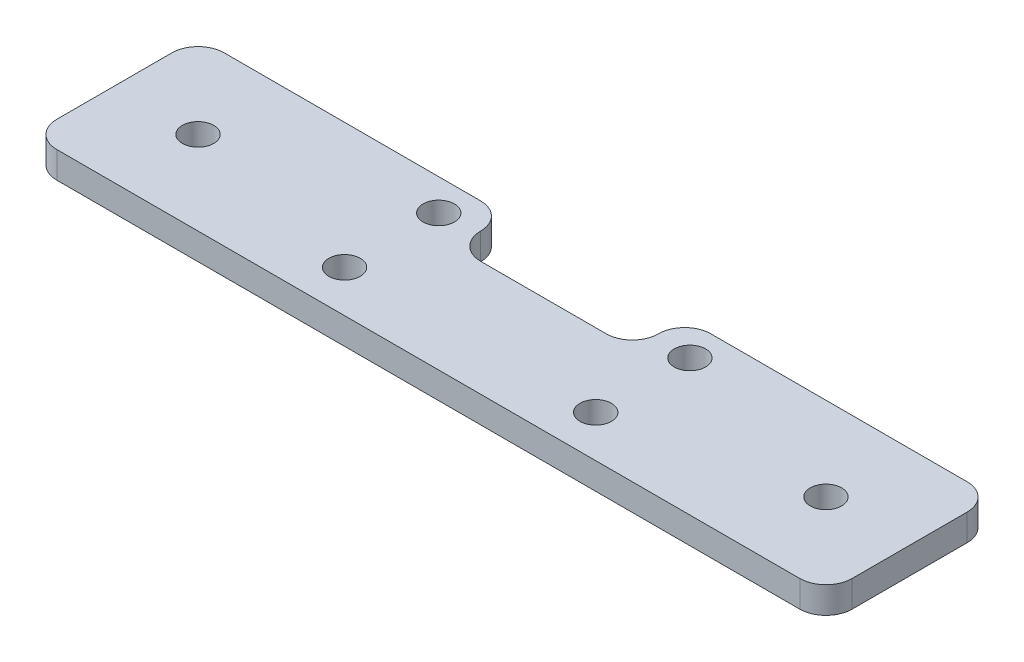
SolidWorks part; units mm, degrees
ref_plane "Front Plane" through (0, 0, 0) normal (0, 0, 1) x (1, 0, 0)
ref_plane "Top Plane" through (0, 0, 0) normal (0, 1, 0) x (1, 0, 0)
ref_plane "Right Plane" through (0, 0, 0) normal (1, 0, 0) x (0, 0, -1)
sketch "Sketch1" plane through (0, 0, 0) normal (0, 1, 0) x (1, 0, 0)
  line L0 (0, 3) -> (0, -8) construction
  line L1 (38, -8) -> (-38, -8)
  line L2 (38, -8) -> (38, 8)
  line L3 (38, 8) -> (8.5, 8)
  line L4 (-38, -8) -> (-38, 8)
  line L5 (38, -8) -> (-38, 8) construction
  line L6 (38, 8) -> (-38, -8) construction
  line L7 (-8.5, 8) -> (-38, 8)
  line L8 (8.5, 3) -> (-8.5, 3)
  line L9 (8.5, 3) -> (8.5, 8)
  line L10 (-38, 0) -> (38, 0) construction
  line L11 (-8.5, 3) -> (-8.5, 8)
  line L12 (8.5, 3) -> (14.3328, 3.0174) construction
  line L13 (-14.3363, 3.0182) -> (-8.5, 3) construction
  circle A0 centre (12, -4) radius 1.5
  circle A1 centre (-30, 0) radius 1.5
  circle A2 centre (-12, -4) radius 1.5
  circle A3 centre (12, 5) radius 1.5
  circle A4 centre (-12, 5) radius 1.5
  circle A5 centre (30, 0) radius 1.5
  point P0 (0, 0)
  point P1 (0, 0)
  dimension "D6" = 3
  dimension "D15" = 3
  dimension "D16" = 3
  dimension "D17" = 3
  dimension "D18" = 30
  dimension "D19" = 3
  dimension "D20" = 3
  dimension "D1" = 76
  dimension "D2" = 16
  dimension "D3" = 8.5
  dimension "D4" = 5
  dimension "D5" = 8.5
  dimension "D7" = 3.5
  dimension "D8" = 3.5
  dimension "D9" = 3.5
  dimension "D10" = 3.5
  dimension "D11" = 9
  dimension "D12" = 3
  dimension "D13" = 3
  dimension "D14" = 9
  dimension "D21" = 30
extrude "Boss-Extrude1" add sketch "Sketch1" along normal blind 2.54
fillet "Fillet1" radius 2.5 8 edges at (-38, 1.27, -8) (-38, 1.27, 8) (38, 1.27, 8) (38, 1.27, -8) (8.5, 1.27, -8) (-8.5, 1.27, -8) (-8.5, 1.27, -3) (8.5, 1.27, -3)
